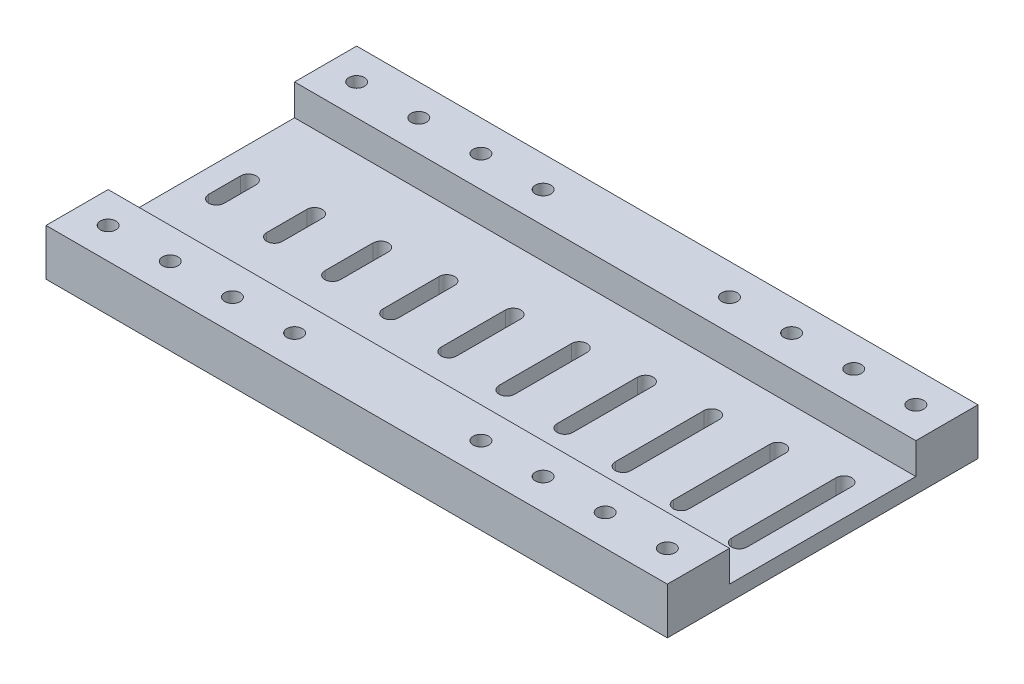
SolidWorks part; units mm, degrees
ref_plane "Ebene vorne" through (0, 0, 0) normal (0, 0, 1) x (1, 0, 0)
ref_plane "Ebene oben" through (0, 0, 0) normal (0, 1, 0) x (1, 0, 0)
ref_plane "Ebene rechts" through (0, 0, 0) normal (1, 0, 0) x (0, 0, -1)
sketch "Skizze1" plane through (0, 0, 0) normal (0, 1, 0) x (1, 0, 0)
  line L1 (-100, 50) -> (100, 50)
  line L2 (-100, 50) -> (-100, -50)
  line L3 (-100, -50) -> (100, -50)
  line L4 (100, 50) -> (100, -50)
  line L5 (-100, 50) -> (100, -50) construction
  line L6 (-100, -50) -> (100, 50) construction
  point P0 (0, 0)
  dimension "D1" = 200
  dimension "D2" = 100
extrude "Aufsatz-Linear austragen1" add sketch "Skizze1" along normal blind 15
sketch "Skizze2" plane through (0, 15, 0) normal (0, 1, 0) x (1, 0, 0)
  line L0 (100, -50) -> (100, 50) construction
  line L1 (-100, 30) -> (100, 30)
  line L2 (-100, 30) -> (-100, -30)
  line L3 (-100, -30) -> (100, -30)
  line L4 (100, 30) -> (100, -30)
  line L5 (-100, 30) -> (100, -30) construction
  line L6 (-100, -30) -> (100, 30) construction
  point P0 (0, 0)
  dimension "D1" = 60
extrude "Schnitt-Linear austragen1" cut sketch "Skizze2" against normal blind 10
hole_wizard "M6 Gewindebohrung1" positions "3D-Skizze1" profile "Skizze3" tap size "M6" standard "DIN"
sketch3d "3D-Skizze1"
  line L0 (-100, 15, 30) -> (100, 15, 30) construction
  line L1 (-100, 15, 30) -> (-100, 15, 50) construction
  point P0 (-90, 15, 40)
  dimension "D1" = 10
  dimension "D2" = 10
sketch "Skizze3" plane through (-90, 15, 40) normal (1, 0, 0) x (0, 0, 1)
  line L0 (0, 0) -> (0, 12.5022)
  line L1 (0, 12.5022) -> (2.5, 11)
  line L2 (2.5, 11) -> (2.5, 0)
  line L5 (2.5, 0) -> (0, 0)
  line L10 (0, 12.5022) -> (-2.5, 11) construction
  line L11 (0, -6.35) -> (0, 107.95) construction
  dimension "Bohrerdurchmesser" = 5
  dimension "Bohrungstiefe" = 11
  dimension "Spitzenwinkel" = 118
pattern_linear "Lineares Muster1" count 10 spacing 20 along (1, 0, 0) of "M6 Gewindebohrung1"
mirror "Spiegeln1" about plane through (0, 0, 0) normal (0, 0, 1) of "Lineares Muster1", "M6 Gewindebohrung1"
sketch "Skizze4" plane through (0, 5, 0) normal (0, 1, 0) x (1, 0, 0)
  line L0 (-90, 5.1447) -> (-90, -5.1447) construction
  line L1 (-87.5, 5.1447) -> (-87.5, -5.1447)
  line L2 (-92.5, 5.1447) -> (-92.5, -5.1447)
  line L3 (-100, 30) -> (-100, -30) construction
  line L5 (-100, 7) -> (100, 20) construction
  line L6 (100, -30) -> (100, 30) construction
  line L7 (-100, -7) -> (100, -20) construction
  line L8 (100, 30) -> (-100, 30) construction
  line L10 (-100, -30) -> (100, -30) construction
  arc A0 (-87.5, 5.1447) -> (-92.5, 5.1447) centre (-90, 5.1447) ccw
  arc A1 (-92.5, -5.1447) -> (-87.5, -5.1447) centre (-90, -5.1447) ccw
  point P2 (-90, 0)
  point P18 (100, -9.4696)
  point P20 (100, -8)
  point P21 (100, -8)
  dimension "D1" = 5
  dimension "D2" = 10
  dimension "D3" = 10
  dimension "D4" = 23
  dimension "D5" = 10
  dimension "D6" = 23
extrude "Schnitt-Linear austragen2" cut sketch "Skizze4" against normal through all
pattern_linear "Lineares Muster4" count 10 spacing 20 of "Schnitt-Linear austragen2"
